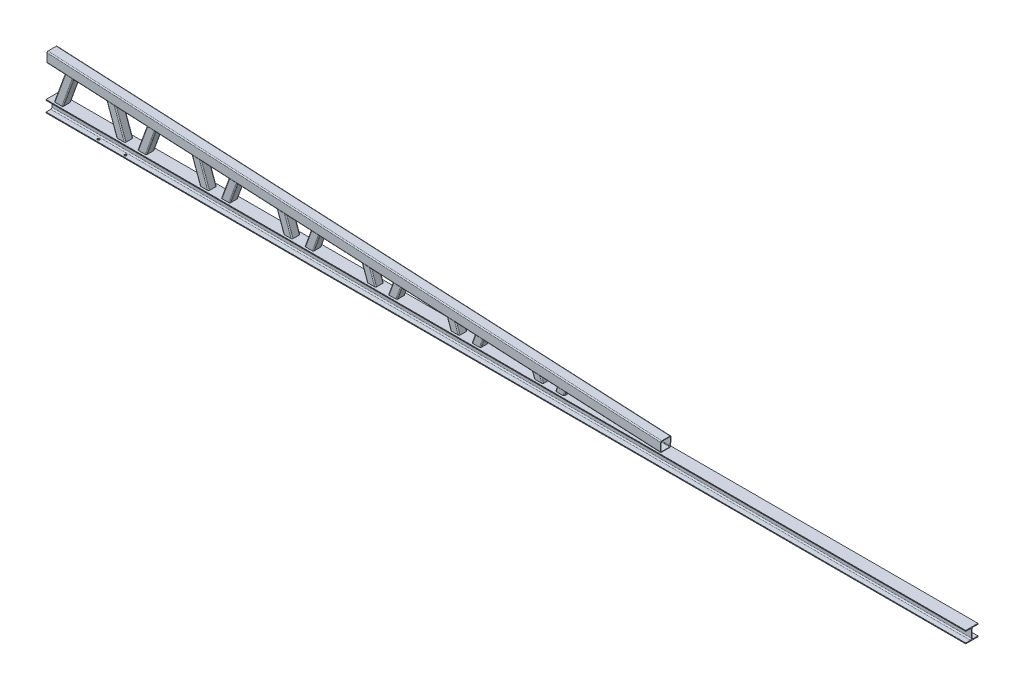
SolidWorks part; units mm, degrees
ref_plane "Default Plane" through (6139.8342, -307.4111, 0) normal (-0.9987, 0.05, 0) x (0, 0, 1)
sketch3d "Ramka-graniczna_100 x 100 x 5.0<1>"
  line L0 (50, 364.9302, 0) -> (-50, 364.9302, 0) construction
  line L1 (-50, 364.9302, 0) -> (-50, 464.9302, 0) construction
  line L2 (-50, 464.9302, 0) -> (50, 464.9302, 0) construction
  line L3 (50, 464.9302, 0) -> (50, 364.9302, 0) construction
  line L4 (50, 364.9302, 6000.5905) -> (-50, 364.9302, 6000.5905) construction
  line L5 (-50, 364.9302, 6000.5905) -> (-50, 464.9302, 6000.5905) construction
  line L6 (-50, 464.9302, 6000.5905) -> (50, 464.9302, 6000.5905) construction
  line L7 (50, 464.9302, 6000.5905) -> (50, 364.9302, 6000.5905) construction
  line L8 (50, 364.9302, 0) -> (50, 364.9302, 6000.5905) construction
  line L9 (-50, 364.9302, 0) -> (-50, 364.9302, 6000.5905) construction
  line L10 (-50, 464.9302, 0) -> (-50, 464.9302, 6000.5905) construction
  line L11 (50, 464.9302, 0) -> (50, 464.9302, 6000.5905) construction
ref_plane "Płaszczyzna przednia" through (0, 0, 0) normal (0, 0, 1) x (1, 0, 0)
ref_plane "Płaszczyzna górna" through (0, 0, 0) normal (0, 1, 0) x (1, 0, 0)
ref_plane "Płaszczyzna prawa" through (0, 0, 0) normal (1, 0, 0) x (0, 0, -1)
sketch "Szkic1" plane through (0, 0, 0) normal (0, 0, 1) x (1, 0, 0)
  line L0 (10.079, 0) -> (9149.969, 0)
  line L1 (0, 163.8371) -> (0, 1900)
  line L2 (0, 415.45) -> (6160.583, 107)
  line L3 (250, 0) -> (394.0309, 395.7215)
  line L4 (762.6873, 377.2635) -> (900, 0)
  line L5 (1065.6291, 0) -> (1195.0624, 355.6152)
  line L6 (1593.4558, 335.6684) -> (1715.6291, 0)
  line L7 (1881.2582, 0) -> (1996.094, 315.5089)
  line L8 (2424.2243, 294.0732) -> (2531.2582, 0)
  line L9 (2696.8872, 0) -> (2797.1256, 275.4026)
  line L10 (3254.9928, 252.478) -> (3346.8872, 0)
  line L11 (3512.5163, 0) -> (3598.1572, 235.2963)
  line L12 (4085.7612, 210.8828) -> (4162.5163, 0)
  line L13 (4328.1454, 0) -> (4399.1888, 195.19)
  line L14 (4916.5297, 169.2877) -> (4978.1454, 0)
  line L15 (5143.7745, 0) -> (5200.2203, 155.0837)
  line L16 (5747.2982, 127.6925) -> (5793.7745, 0)
  line L18 (9149.969, 0) -> (9149.969, 344.9055) construction
other "Heb 300 - configured HEB 300<OBROBIONA>(1)"
ref_plane "Płaszczyzna1" through (0, 163.8371, 0) normal (0, 1, 0) x (0, 0, 1)
sketch "Szkic11" plane through (0, 163.8371, 0) normal (0, 1, 0) x (0, 0, 1)
  line L0 (-147, 150) -> (147, 150)
  line L1 (-150, 150) -> (150, 150) construction
  line L2 (-150, 150) -> (-150, 131) construction
  line L3 (-150, -150) -> (150, -150) construction
  line L4 (150, 150) -> (150, 131) construction
  line L5 (-150, 150) -> (150, -150) construction
  line L6 (-150, -150) -> (150, 150) construction
  line L7 (-147, 131) -> (-32.5, 131)
  line L8 (-147, -150) -> (147, -150)
  line L9 (-147, -131) -> (-32.5, -131)
  line L10 (-5.5, 104) -> (-5.5, -104)
  line L11 (0, 131) -> (0, -131) construction
  line L12 (5.5, 104) -> (5.5, -104)
  line L13 (-150, 147) -> (-150, 134)
  line L14 (150, 147) -> (150, 134)
  line L15 (150, -131) -> (150, -150) construction
  line L16 (150, -134) -> (150, -147)
  line L17 (-150, -131) -> (-150, -150) construction
  line L18 (-150, -134) -> (-150, -147)
  line L19 (32.5, 131) -> (147, 131)
  line L20 (32.5, -131) -> (147, -131)
  arc A0 (-5.5, -104) -> (-32.5, -131) centre (-32.5, -104) cw
  arc A1 (5.5, -104) -> (32.5, -131) centre (32.5, -104) ccw
  arc A2 (-5.5, 104) -> (-32.5, 131) centre (-32.5, 104) ccw
  arc A3 (5.5, 104) -> (32.5, 131) centre (32.5, 104) cw
  arc A4 (150, -147) -> (147, -150) centre (147, -147) cw
  arc A5 (147, -131) -> (150, -134) centre (147, -134) cw
  arc A6 (-150, -147) -> (-147, -150) centre (-147, -147) ccw
  arc A7 (-147, -131) -> (-150, -134) centre (-147, -134) ccw
  arc A8 (147, 131) -> (150, 134) centre (147, 134) ccw
  arc A9 (150, 147) -> (147, 150) centre (147, 147) ccw
  arc A10 (-147, 131) -> (-150, 134) centre (-147, 134) cw
  arc A11 (-150, 147) -> (-147, 150) centre (-147, 147) cw
  point P0 (0, 0)
  point P20 (5.5, -131)
  point P25 (5.5, 131)
  point P50 (0, 0)
  dimension "D6" = 27
  dimension "D7" = 3
  dimension "D1" = 300
  dimension "D2" = 300
  dimension "D3" = 19
  dimension "D4" = 19
  dimension "D5" = 11
other "Tube (square) 100 X 100 X 5.0(5)"
ref_plane "Płaszczyzna2" through (0, 415.45, 0) normal (0.9987, -0.05, 0) x (0.05, 0.9987, 0)
sketch "Sketch1" plane through (0, 415.45, 0) normal (0.9987, -0.05, 0) x (0.05, 0.9987, 0)
  line L0 (-40, -45) -> (40, -45)
  line L1 (-45, -40) -> (-45, 40)
  line L2 (40, 45) -> (-40, 45)
  line L3 (45, 40) -> (45, -40)
  line L4 (-40, -50) -> (40, -50)
  line L5 (-50, -40) -> (-50, 40)
  line L6 (40, 50) -> (-40, 50)
  line L7 (50, 40) -> (50, -40)
  line L8 (-50, 0) -> (-45, 0) construction
  line L9 (-45, 0) -> (45, 0) construction
  line L10 (45, 0) -> (50, 0) construction
  line L12 (0, 50) -> (0, 45) construction
  line L13 (0, 45) -> (0, -45) construction
  line L14 (0, -45) -> (0, -50) construction
  arc A0 (50, 40) -> (40, 50) centre (40, 40) ccw
  arc A1 (40, -50) -> (50, -40) centre (40, -40) ccw
  arc A2 (-50, -40) -> (-40, -50) centre (-40, -40) ccw
  arc A3 (-40, 50) -> (-50, 40) centre (-40, 40) ccw
  arc A4 (-40, 45) -> (-45, 40) centre (-40, 40) ccw
  arc A5 (45, 40) -> (40, 45) centre (40, 40) ccw
  arc A6 (40, -45) -> (45, -40) centre (40, -40) ccw
  arc A7 (-45, -40) -> (-40, -45) centre (-40, -40) ccw
  point P2 (-50, 50)
  point P33 (-50, -50)
  point P34 (50, -50)
  point P36 (50, 50)
  point P37 (0, 0)
  dimension "D1" = 10
  dimension "Thickness" = 5
  dimension "V_leg" = 100
  dimension "H_leg" = 100
ref_plane "Płaszczyzna4" through (0, 159.3021, 0) normal (0, 1, 0) x (1, 0, 0)
ref_plane "Płaszczyzna5" through (0, 94.3021, 0) normal (0, 1, 0) x (1, 0, 0)
other "Hea 120 - configured HEA 120(1)"
ref_plane "Płaszczyzna7" through (0, 415.45, 0) normal (0.9987, -0.05, 0) x (0, 0, 1)
sketch "Szkic116" plane through (0, 415.45, 0) normal (0.9987, -0.05, 0) x (0, 0, 1)
  line L0 (-60, 49) -> (-14.5, 49)
  line L1 (-60, 57) -> (60, 57)
  line L2 (-60, 57) -> (-60, 49)
  line L3 (-60, -57) -> (60, -57)
  line L4 (60, 57) -> (60, 49)
  line L5 (-60, 57) -> (60, -57) construction
  line L6 (-60, -57) -> (60, 57) construction
  line L7 (-60, -49) -> (-14.5, -49)
  line L8 (-2.5, 37) -> (-2.5, -37)
  line L9 (2.5, 37) -> (2.5, -37)
  line L10 (0, 0) -> (0, -25.7377) construction
  line L11 (-60, -49) -> (-60, -57)
  line L12 (60, -49) -> (60, -57)
  line L13 (14.5, -49) -> (60, -49)
  line L14 (14.5, 49) -> (60, 49)
  arc A0 (-2.5, -37) -> (-14.5, -49) centre (-14.5, -37) cw
  arc A1 (2.5, -37) -> (14.5, -49) centre (14.5, -37) ccw
  arc A2 (2.5, 37) -> (14.5, 49) centre (14.5, 37) cw
  arc A3 (-2.5, 37) -> (-14.5, 49) centre (-14.5, 37) ccw
  point P0 (0, 0)
  point P20 (2.5, -49)
  point P23 (2.5, 49)
  point P26 (0, 0)
  dimension "D7" = 12
  dimension "D1" = 120
  dimension "D2" = 114
  dimension "D3" = 2.5
  dimension "D4" = 2.5
  dimension "D5" = 8
  dimension "D6" = 8
other "Przytnij/Wydłuż1"
other "Tube (square) 80 X 80 X 5.0(8)"
ref_plane "Płaszczyzna9" through (250, 0, 0) normal (0.342, 0.9397, 0) x (-0.9397, 0.342, 0)
sketch "Sketch12" plane through (250, 0, 0) normal (0.342, 0.9397, 0) x (-0.9397, 0.342, 0)
  line L0 (-30, -35) -> (30, -35)
  line L1 (-35, -30) -> (-35, 30)
  line L2 (30, 35) -> (-30, 35)
  line L3 (35, 30) -> (35, -30)
  line L4 (-30, -40) -> (30, -40)
  line L5 (-40, -30) -> (-40, 30)
  line L6 (30, 40) -> (-30, 40)
  line L7 (40, 30) -> (40, -30)
  line L8 (-40, 0) -> (-35, 0) construction
  line L9 (-35, 0) -> (35, 0) construction
  line L10 (35, 0) -> (40, 0) construction
  line L12 (0, 40) -> (0, 35) construction
  line L13 (0, 35) -> (0, -35) construction
  line L14 (0, -35) -> (0, -40) construction
  arc A0 (40, 30) -> (30, 40) centre (30, 30) ccw
  arc A1 (30, -40) -> (40, -30) centre (30, -30) ccw
  arc A2 (-40, -30) -> (-30, -40) centre (-30, -30) ccw
  arc A3 (-30, 40) -> (-40, 30) centre (-30, 30) ccw
  arc A4 (-30, 35) -> (-35, 30) centre (-30, 30) ccw
  arc A5 (35, 30) -> (30, 35) centre (30, 30) ccw
  arc A6 (30, -35) -> (35, -30) centre (30, -30) ccw
  arc A7 (-35, -30) -> (-30, -35) centre (-30, -30) ccw
  point P2 (-40, 40)
  point P33 (-40, -40)
  point P34 (40, -40)
  point P36 (40, 40)
  point P37 (0, 0)
  dimension "D1" = 10
  dimension "Thickness" = 5
  dimension "V_leg" = 80
  dimension "H_leg" = 80
other "Przytnij/Wydłuż2"
sketch "Szkic117" plane through (0, -57, 0) normal (0, -1, 0) x (1, 0, 0)
  circle A6 centre (656.7868, 35) radius 11
  circle A7 centre (656.7868, -35) radius 11
  circle A8 centre (922.7868, 35) radius 11
  circle A10 centre (922.7868, -35) radius 11
  dimension "D1" = 266
extrude "Wytnij-wyciągnięcie1" cut sketch "Szkic117" against normal blind 20
sketch "Szkic118" plane through (0, 1900, 0) normal (0, 1, 0) x (1, 0, 0)
  line L1 (-185.7077, 173.8582) -> (162.1674, 173.8582)
  line L2 (-185.7077, 173.8582) -> (-185.7077, -246.8279)
  line L3 (-185.7077, -246.8279) -> (162.1674, -246.8279)
  line L4 (162.1674, 173.8582) -> (162.1674, -246.8279)
  line L5 (-185.7077, 173.8582) -> (162.1674, -246.8279) construction
  line L6 (-185.7077, -246.8279) -> (162.1674, 173.8582) construction
  point P4 (-11.7702, -36.4848)
extrude "Wytnij-wyciągnięcie2" cut sketch "Szkic118" against normal blind 1820
other "Zapisz obiekty1"
equation "\"D1@Szkic1\"=400.00mm+3.45+12"
